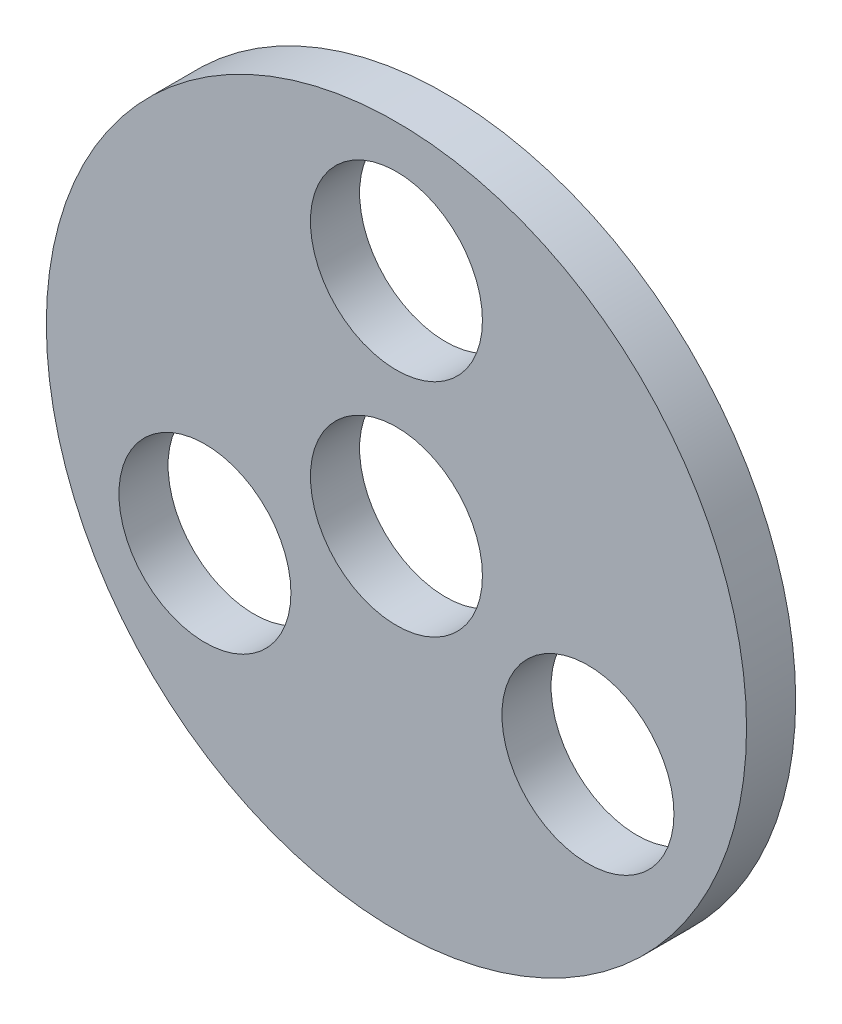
SolidWorks part; units mm, degrees
ref_plane "Face" through (0, 0, 0) normal (0, 0, 1) x (1, 0, 0)
ref_plane "Dessus" through (0, 0, 0) normal (0, 1, 0) x (1, 0, 0)
ref_plane "Droite" through (0, 0, 0) normal (1, 0, 0) x (0, 0, -1)
sketch "Esquisse1" plane through (0, 0, 0) normal (0, 0, 1) x (1, 0, 0)
  circle A0 centre (0, 0) radius 14.25
  circle A1 centre (0, 9) radius 3.5
  circle A2 centre (7.7942, -4.5) radius 3.5
  circle A3 centre (-7.7942, -4.5) radius 3.5
  circle A4 centre (0, 0) radius 3.5
  dimension "D1" = 28.5
  dimension "D2" = 7
  dimension "D4" = 7
  dimension "D3" = 9
extrude "Extrusion1" add sketch "Esquisse1" along normal blind 2
